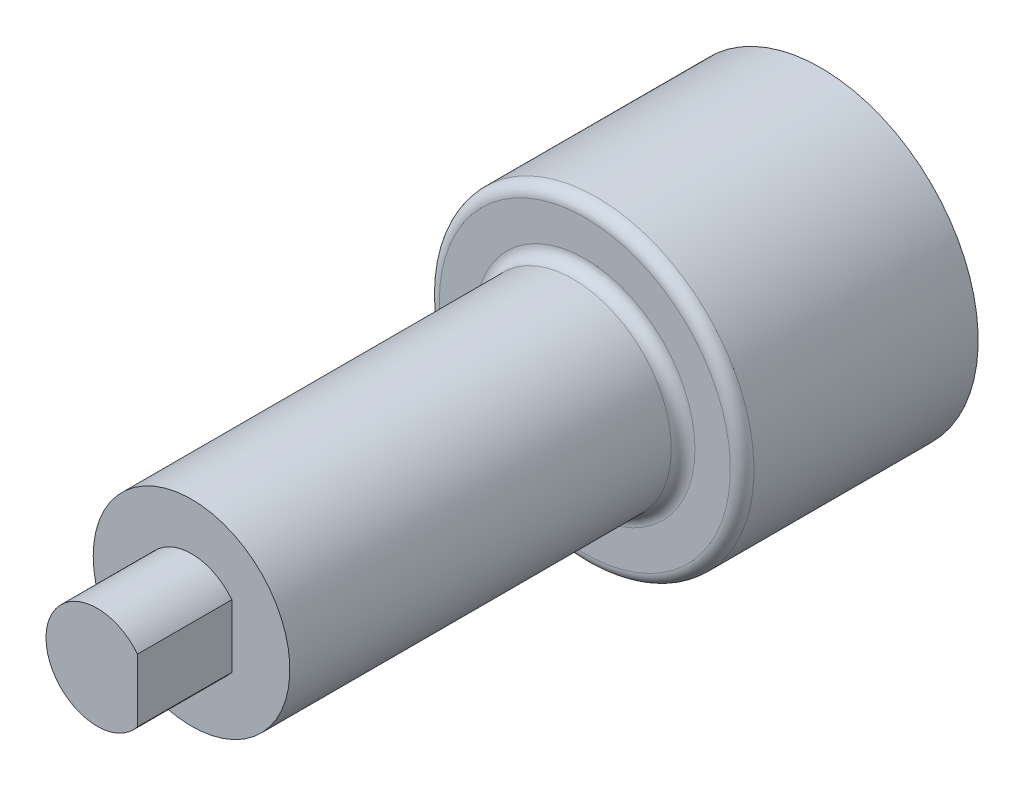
SolidWorks part; units mm, degrees
ref_plane "Front" through (0, 0, 0) normal (0, 0, 1) x (1, 0, 0)
ref_plane "Top" through (0, 0, 0) normal (0, 1, 0) x (1, 0, 0)
ref_plane "Right" through (0, 0, 0) normal (1, 0, 0) x (0, 0, -1)
sketch "Sketch1" plane through (0, 0, 0) normal (0, 0, 1) x (1, 0, 0)
  line L0 (5.1235, -4) -> (5.1235, 4)
  arc A0 (5.1235, 4) -> (5.1235, -4) centre (0, 0) ccw
  dimension "D1" = 13
  dimension "D2" = 8
extrude "Extrude1" add sketch "Sketch1" against normal blind 12
sketch "Sketch2" plane through (0, 0, -12) normal (0, 0, -1) x (-1, 0, 0)
  circle A0 centre (0, 0) radius 12.5
  dimension "D1" = 25
extrude "Extrude2" add sketch "Sketch2" along normal blind 50
sketch "Sketch3" plane through (0, 0, -62) normal (0, 0, -1) x (-1, 0, 0)
  circle A0 centre (0, 0) radius 20
  dimension "D1" = 40
extrude "Extrude3" add sketch "Sketch3" along normal blind 30
fillet "Fillet1" radius 1.5 2 edges at (-12.5, 0, -62) (-20, 0, -62)
